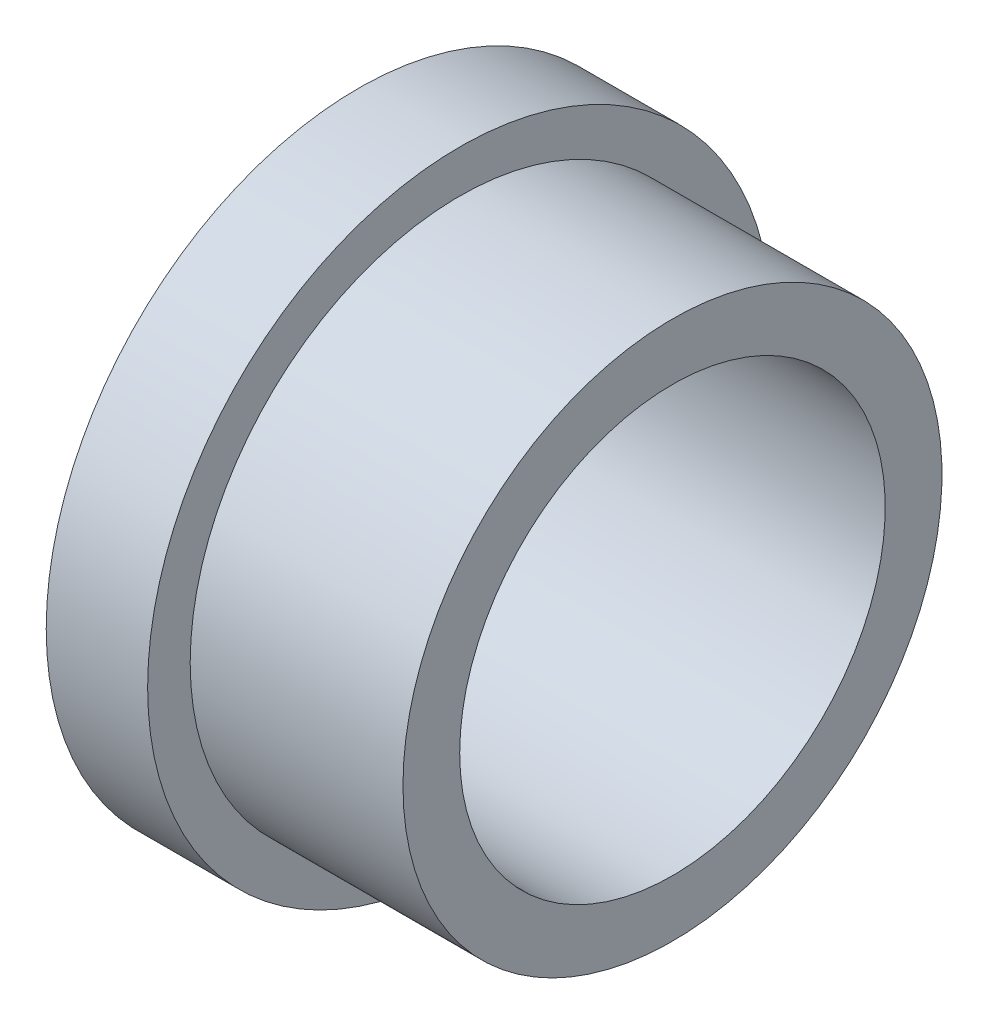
SolidWorks part; units mm, degrees
ref_plane "Face" through (0, 0, 0) normal (0, 0, 1) x (1, 0, 0)
ref_plane "Dessus" through (0, 0, 0) normal (0, 1, 0) x (1, 0, 0)
ref_plane "Droite" through (0, 0, 0) normal (1, 0, 0) x (0, 0, -1)
sketch "Esquisse1" plane through (0, 0, 0) normal (0, 0, 1) x (1, 0, 0)
  line L0 (0, 0) -> (80.6943, 0) construction
  line L1 (18.4991, 22) -> (18.4991, 15)
  line L2 (18.4991, 22) -> (25.6491, 22)
  line L3 (25.6491, 22) -> (25.6491, 19)
  line L4 (25.6491, 19) -> (40.6491, 19)
  line L5 (40.6491, 19) -> (40.6491, 15)
  line L6 (40.6491, 15) -> (18.4991, 15)
  dimension "D1" = 30
  dimension "D2" = 38
  dimension "D3" = 44
  dimension "D4" = 7.15
  dimension "D5" = 15
revolve "Révolution1" add sketch "Esquisse1" angle 360 about L0
